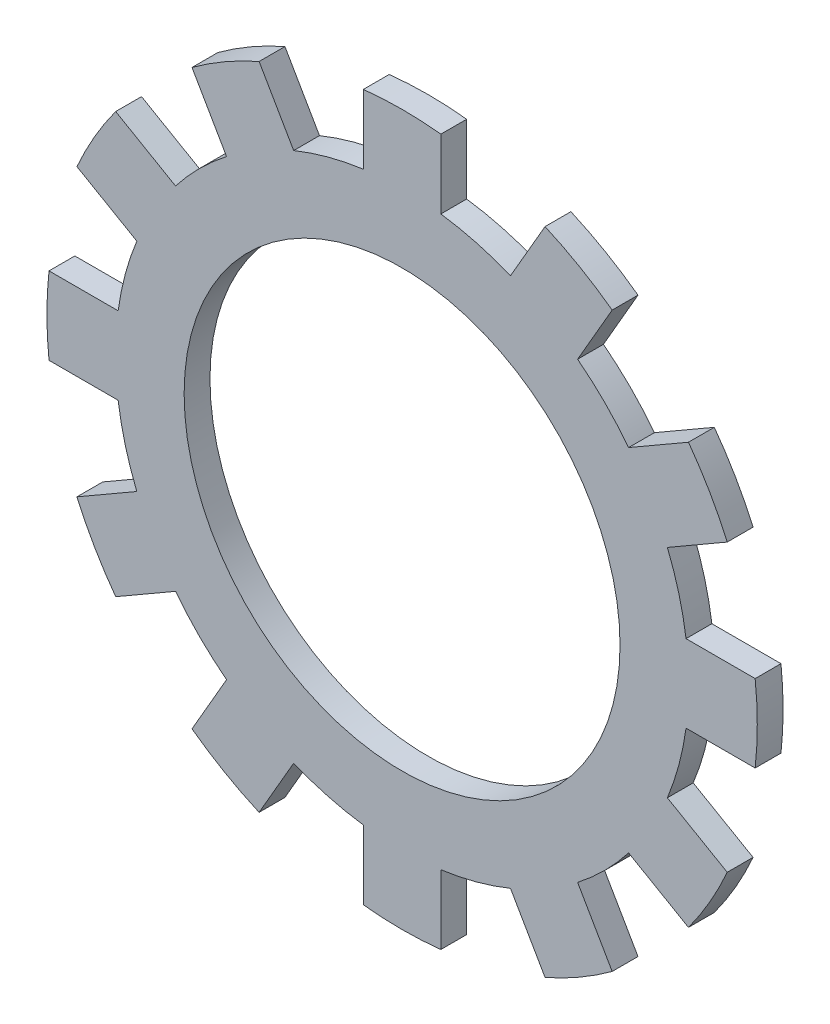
SolidWorks part; units mm, degrees
ref_plane "Front Plane" through (0, 0, 0) normal (0, 0, 1) x (1, 0, 0)
ref_plane "Top Plane" through (0, 0, 0) normal (0, 1, 0) x (1, 0, 0)
ref_plane "Right Plane" through (0, 0, 0) normal (1, 0, 0) x (0, 0, -1)
sketch "Sketch1" plane through (0, 0, 0) normal (0, 0, 1) x (1, 0, 0)
  circle A0 centre (0, 0) radius 13.5
  circle A1 centre (0, 0) radius 17.75
  dimension "D1" = 27
  dimension "D2" = 35.5
extrude "Boss-Extrude1" add sketch "Sketch1" along normal mid plane 1.6
sketch "Sketch2" plane through (0, 0, 0) normal (0, 0, 1) x (1, 0, 0)
  line L0 (0, 2.6811) -> (0, -2.8425) construction
sketch "Sketch3" plane through (0, 0, 0) normal (0, 0, 1) x (1, 0, 0)
  line L0 (-2.4, 21.8687) -> (-2.4, 17.587)
  line L2 (0, 2.6811) -> (0, -2.8425) construction
  line L3 (0, 17.75) -> (0, 22)
  arc A0 (0, 22) -> (-2.4, 21.8687) centre (0, 0) ccw
  arc A1 (0, 17.75) -> (-2.4, 17.587) centre (0, 0) ccw
  circle A2 centre (0, 0) radius 17.75 construction
  dimension "D2" = 22
  dimension "D1" = 2.4
extrude "Boss-Extrude2" add sketch "Sketch3" along normal mid plane 1.6
mirror "Mirror1" about plane through (0, 0, 0) normal (1, 0, 0) of "Boss-Extrude2"
pattern_circular "CirPattern2" count 12 over 360 about axis through (0, 0, 0) along (0, 0, 1) of "Boss-Extrude2", "Mirror1"
